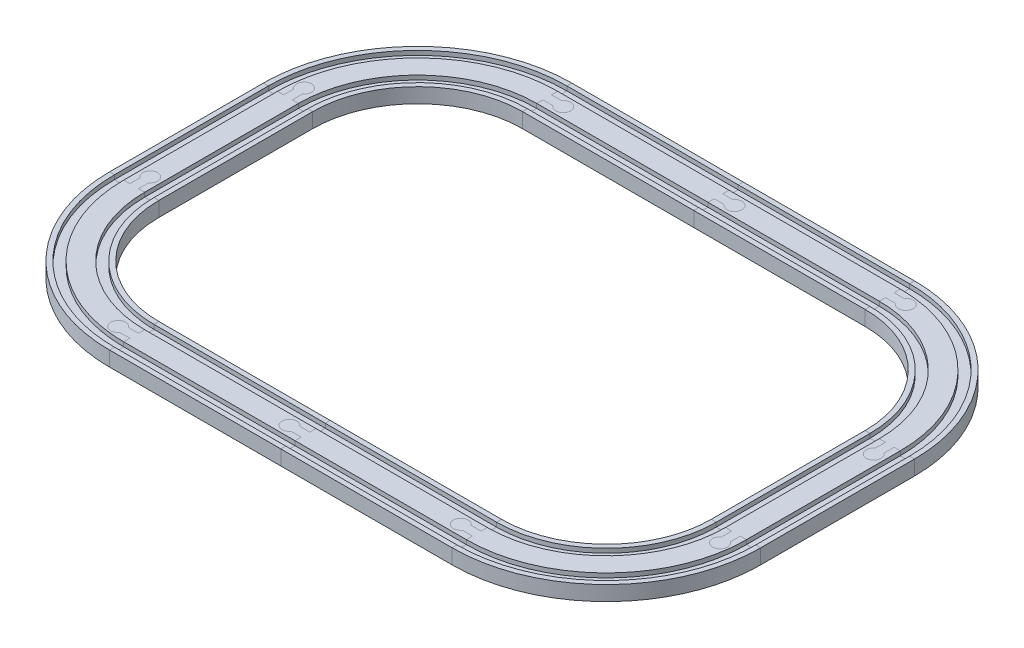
SolidWorks part; units mm, degrees
ref_plane "Front Plane" through (0, 0, 0) normal (0, 0, 1) x (1, 0, 0)
ref_plane "Top Plane" through (0, 0, 0) normal (0, 1, 0) x (1, 0, 0)
ref_plane "Right Plane" through (0, 0, 0) normal (1, 0, 0) x (0, 0, -1)
sketch "Sketch1" plane through (0, 0, 0) normal (0, 1, 0) x (1, 0, 0)
  line L0 (-984.3778, 325.8972) -> (-706.7779, 325.8972)
  line L1 (-1109.3778, 200.8972) -> (-1109.3778, 76.2735)
  line L2 (-621.7779, 200.8972) -> (-621.7779, 76.2735)
  line L3 (-1069.3778, 200.8972) -> (-1069.3778, 76.2735)
  line L4 (-581.7779, 200.8972) -> (-581.7779, 76.2735)
  line L5 (-706.7779, -48.7265) -> (-984.3778, -48.7265)
  line L6 (-984.3778, -8.7265) -> (-706.7779, -8.7265)
  spline S0 degree 2 poles (-706.7779, 325.8972) (-706.7779, 325.8972) (-706.7779, 325.8972) knots 0.111111 0.111111 0.111111 0.111111 0.111111 0.111111
  spline S1 degree 3 poles (-706.7779, 325.8972) (-638.0279, 325.8972) (-581.7779, 269.6472) (-581.7779, 200.8972) knots 0.111111 0.111111 0.111111 0.111111 0.222222 0.222222 0.222222 0.222222
  spline S3 degree 2 poles (-581.7779, 76.2735) (-581.7779, 76.2735) (-581.7779, 76.2735) knots 0.333333 0.333333 0.333333 0.333333 0.333333 0.333333
  spline S4 degree 3 poles (-581.7779, 76.2735) (-581.7779, 7.5235) (-638.0279, -48.7265) (-706.7779, -48.7265) knots 0.333333 0.333333 0.333333 0.333333 0.444444 0.444444 0.444444 0.444444
  spline S7 degree 3 poles (-984.3778, -48.7265) (-1053.1278, -48.7265) (-1109.3778, 7.5235) (-1109.3778, 76.2735) knots 0.555556 0.555556 0.555556 0.555556 0.666667 0.666667 0.666667 0.666667
  spline S9 degree 3 poles (-1109.3778, 200.8972) (-1109.3778, 269.6472) (-1053.1278, 325.8972) (-984.3778, 325.8972) knots 0.777778 0.777778 0.777778 0.777778 1 1 1 1
  spline S10 degree 3 poles (-984.3778, 285.8972) (-1031.0488, 285.8972) (-1069.3778, 247.5682) (-1069.3778, 200.8972) knots 0 0 0 0 0.111111 0.111111 0.111111 0.111111
  spline S12 degree 3 poles (-1069.3778, 76.2735) (-1069.3778, 29.6025) (-1031.0488, -8.7265) (-984.3778, -8.7265) knots 0.222222 0.222222 0.222222 0.222222 0.333333 0.333333 0.333333 0.333333
  spline S14 degree 3 poles (-706.7779, -8.7265) (-660.1069, -8.7265) (-621.7779, 29.6025) (-621.7779, 76.2735) knots 0.444444 0.444444 0.444444 0.444444 0.555556 0.555556 0.555556 0.555556
  spline S16 degree 3 poles (-621.7779, 200.8972) (-621.7779, 247.5682) (-660.1069, 285.8972) (-706.7779, 285.8972) knots 0.666667 0.666667 0.666667 0.666667 0.777778 0.777778 0.777778 0.777778
  spline S17 degree 2 poles (-706.7779, 285.8972) (-706.7779, 285.8972) (-984.3778, 285.8972) knots 0.777778 0.777778 0.777778 1 1 1
extrude "Boss-Extrude1" add sketch "Sketch1" along normal blind 12
sketch "Sketch2" plane through (0, 12, 0) normal (0, 1, 0) x (1, 0, 0)
  spline S0 degree 3 poles (-984.3778, 321.8972) (-1050.9199, 321.8972) (-1105.3778, 267.4393) (-1105.3778, 200.8972) knots 0 0 0 0 0.111111 0.111111 0.111111 0.111111
  spline S1 degree 2 poles (-1105.3778, 200.8972) (-1105.3778, 200.8972) (-1105.3778, 76.2735) knots 0.111111 0.111111 0.111111 0.222222 0.222222 0.222222
  spline S2 degree 2 poles (-1105.3778, 76.2735) (-1105.3778, 76.2735) (-1105.3778, 76.2735) knots 0.222222 0.222222 0.222222 0.222222 0.222222 0.222222
  spline S3 degree 3 poles (-1105.3778, 76.2735) (-1105.3778, 9.7314) (-1050.9199, -44.7265) (-984.3778, -44.7265) knots 0.222222 0.222222 0.222222 0.222222 0.333333 0.333333 0.333333 0.333333
  spline S4 degree 2 poles (-984.3778, -44.7265) (-984.3778, -44.7265) (-706.7779, -44.7265) knots 0.333333 0.333333 0.333333 0.444444 0.444444 0.444444
  spline S5 degree 2 poles (-706.7779, -44.7265) (-706.7779, -44.7265) (-706.7779, -44.7265) knots 0.444444 0.444444 0.444444 0.444444 0.444444 0.444444
  spline S6 degree 3 poles (-706.7779, -44.7265) (-640.2358, -44.7265) (-585.7779, 9.7314) (-585.7779, 76.2735) knots 0.444444 0.444444 0.444444 0.444444 0.555556 0.555556 0.555556 0.555556
  spline S7 degree 2 poles (-585.7779, 76.2735) (-585.7779, 76.2735) (-585.7779, 200.8972) knots 0.555556 0.555556 0.555556 0.666667 0.666667 0.666667
  spline S9 degree 3 poles (-585.7779, 200.8972) (-585.7779, 267.4393) (-640.2358, 321.8972) (-706.7779, 321.8972) knots 0.666667 0.666667 0.666667 0.666667 0.777778 0.777778 0.777778 0.777778
  spline S10 degree 2 poles (-706.7779, 321.8972) (-706.7779, 321.8972) (-984.3778, 321.8972) knots 0.777778 0.777778 0.777778 1 1 1
  spline S11 degree 3 poles (-984.3778, 314.3972) (-1046.7801, 314.3972) (-1097.8778, 263.2995) (-1097.8778, 200.8972) knots 0 0 0 0 0.111111 0.111111 0.111111 0.111111
  spline S12 degree 2 poles (-1097.8778, 200.8972) (-1097.8778, 200.8972) (-1097.8778, 76.2735) knots 0.111111 0.111111 0.111111 0.222222 0.222222 0.222222
  spline S13 degree 2 poles (-1097.8778, 76.2735) (-1097.8778, 76.2735) (-1097.8778, 76.2735) knots 0.222222 0.222222 0.222222 0.222222 0.222222 0.222222
  spline S14 degree 3 poles (-1097.8778, 76.2735) (-1097.8778, 13.8712) (-1046.7801, -37.2265) (-984.3778, -37.2265) knots 0.222222 0.222222 0.222222 0.222222 0.333333 0.333333 0.333333 0.333333
  spline S15 degree 2 poles (-984.3778, -37.2265) (-984.3778, -37.2265) (-706.7779, -37.2265) knots 0.333333 0.333333 0.333333 0.444444 0.444444 0.444444
  spline S16 degree 2 poles (-706.7779, -37.2265) (-706.7779, -37.2265) (-706.7779, -37.2265) knots 0.444444 0.444444 0.444444 0.444444 0.444444 0.444444
  spline S17 degree 3 poles (-706.7779, -37.2265) (-644.3756, -37.2265) (-593.2779, 13.8712) (-593.2779, 76.2735) knots 0.444444 0.444444 0.444444 0.444444 0.555556 0.555556 0.555556 0.555556
  spline S18 degree 2 poles (-593.2779, 76.2735) (-593.2779, 76.2735) (-593.2779, 200.8972) knots 0.555556 0.555556 0.555556 0.666667 0.666667 0.666667
  spline S20 degree 3 poles (-593.2779, 200.8972) (-593.2779, 263.2995) (-644.3756, 314.3972) (-706.7779, 314.3972) knots 0.666667 0.666667 0.666667 0.666667 0.777778 0.777778 0.777778 0.777778
  spline S21 degree 2 poles (-706.7779, 314.3972) (-706.7779, 314.3972) (-984.3778, 314.3972) knots 0.777778 0.777778 0.777778 1 1 1
  spline S22 degree 3 poles (-984.3778, 297.3972) (-1037.3965, 297.3972) (-1080.8778, 253.9159) (-1080.8778, 200.8972) knots 0 0 0 0 0.111111 0.111111 0.111111 0.111111
  spline S23 degree 2 poles (-1080.8778, 200.8972) (-1080.8778, 200.8972) (-1080.8778, 76.2735) knots 0.111111 0.111111 0.111111 0.222222 0.222222 0.222222
  spline S24 degree 3 poles (-1080.8778, 76.2735) (-1080.8778, 23.2548) (-1037.3965, -20.2265) (-984.3778, -20.2265) knots 0.222222 0.222222 0.222222 0.222222 0.333333 0.333333 0.333333 0.333333
  spline S25 degree 2 poles (-984.3778, -20.2265) (-984.3778, -20.2265) (-706.7779, -20.2265) knots 0.333333 0.333333 0.333333 0.444444 0.444444 0.444444
  spline S26 degree 3 poles (-706.7779, -20.2265) (-653.7592, -20.2265) (-610.2779, 23.2548) (-610.2779, 76.2735) knots 0.444444 0.444444 0.444444 0.444444 0.555556 0.555556 0.555556 0.555556
  spline S27 degree 2 poles (-610.2779, 76.2735) (-610.2779, 76.2735) (-610.2779, 200.8972) knots 0.555556 0.555556 0.555556 0.666667 0.666667 0.666667
  spline S28 degree 3 poles (-610.2779, 200.8972) (-610.2779, 253.9159) (-653.7592, 297.3972) (-706.7779, 297.3972) knots 0.666667 0.666667 0.666667 0.666667 0.777778 0.777778 0.777778 0.777778
  spline S29 degree 2 poles (-706.7779, 297.3972) (-706.7779, 297.3972) (-984.3778, 297.3972) knots 0.777778 0.777778 0.777778 1 1 1
  spline S30 degree 3 poles (-984.3778, 289.8972) (-1033.2567, 289.8972) (-1073.3778, 249.7761) (-1073.3778, 200.8972) knots 0 0 0 0 0.111111 0.111111 0.111111 0.111111
  spline S31 degree 2 poles (-1073.3778, 200.8972) (-1073.3778, 200.8972) (-1073.3778, 76.2735) knots 0.111111 0.111111 0.111111 0.222222 0.222222 0.222222
  spline S32 degree 3 poles (-1073.3778, 76.2735) (-1073.3778, 27.3946) (-1033.2567, -12.7265) (-984.3778, -12.7265) knots 0.222222 0.222222 0.222222 0.222222 0.333333 0.333333 0.333333 0.333333
  spline S33 degree 2 poles (-984.3778, -12.7265) (-984.3778, -12.7265) (-706.7779, -12.7265) knots 0.333333 0.333333 0.333333 0.444444 0.444444 0.444444
  spline S34 degree 3 poles (-706.7779, -12.7265) (-657.899, -12.7265) (-617.7779, 27.3946) (-617.7779, 76.2735) knots 0.444444 0.444444 0.444444 0.444444 0.555556 0.555556 0.555556 0.555556
  spline S35 degree 2 poles (-617.7779, 76.2735) (-617.7779, 76.2735) (-617.7779, 200.8972) knots 0.555556 0.555556 0.555556 0.666667 0.666667 0.666667
  spline S36 degree 3 poles (-617.7779, 200.8972) (-617.7779, 249.7761) (-657.899, 289.8972) (-706.7779, 289.8972) knots 0.666667 0.666667 0.666667 0.666667 0.777778 0.777778 0.777778 0.777778
  spline S37 degree 2 poles (-706.7779, 289.8972) (-706.7779, 289.8972) (-984.3778, 289.8972) knots 0.777778 0.777778 0.777778 1 1 1
extrude "Cut-Extrude1" cut sketch "Sketch2" against normal blind 3.5 contours S9 S10 S0 S1 S3 S4 S6 S7 S21 S20 S18 S17 S15 S14 S12 S11 | S28 S29 S22 S23 S24 S25 S26 S27 S37 S36 S35 S34 S33 S32 S31 S30
sketch "Sketch3" plane through (0, 12, 0) normal (0, 1, 0) x (1, 0, 0)
  line L0 (-984.3778, 325.8972) -> (-984.3778, 309.3971)
  line L1 (-845.5778, 325.8972) -> (-845.5778, 309.3971)
  line L2 (-706.7779, 325.8972) -> (-706.7779, 309.3971)
  line L3 (-706.7779, -8.7265) -> (-706.7779, -25.2266)
  line L4 (-845.5779, -8.7265) -> (-845.5779, -25.2266)
  line L5 (-984.3778, -8.7265) -> (-984.3778, -25.2266)
  line L6 (-621.7779, 200.8972) -> (-605.2778, 200.8972)
  line L7 (-621.7779, 76.2735) -> (-605.2778, 76.2735)
  line L8 (-1109.3778, 76.2735) -> (-1092.8777, 76.2735)
  line L9 (-1109.3778, 200.8972) -> (-1092.8777, 200.8972)
  line L10 (-1085.8777, 200.8972) -> (-1069.3778, 200.8972)
  line L11 (-1085.8777, 76.2735) -> (-1069.3778, 76.2735)
  line L12 (-984.3778, 302.3971) -> (-984.3778, 285.8972)
  line L13 (-845.5778, 302.3971) -> (-845.5778, 285.8972)
  line L14 (-984.3778, 285.8972) -> (-706.7779, 285.8972) construction
  line L15 (-706.7779, 302.3971) -> (-706.7779, 285.8972)
  line L16 (-598.2778, 200.8972) -> (-581.7779, 200.8972)
  line L17 (-598.2778, 76.2735) -> (-581.7779, 76.2735)
  line L18 (-706.7779, -32.2266) -> (-706.7779, -48.7265)
  line L19 (-845.5779, -32.2266) -> (-845.5779, -48.7265)
  line L21 (-984.3778, -32.2408) -> (-984.3778, -48.7265)
  spline S0 degree 2 poles (-984.3778, 309.3971) (-984.3778, 309.3971) (-976.2513, 309.3971) knots 0.111111 0.111111 0.111111 0.222222 0.222222 0.222222
  spline S1 degree 3 poles (-976.2513, 309.3971) (-975.1621, 310.9111) (-973.3852, 311.8971) (-971.3778, 311.8971) knots 0.222222 0.222222 0.222222 0.222222 0.333333 0.333333 0.333333 0.333333
  spline S2 degree 3 poles (-971.3778, 311.8971) (-968.0641, 311.8971) (-965.3778, 309.2108) (-965.3778, 305.8971) knots 0.333333 0.333333 0.333333 0.333333 0.444444 0.444444 0.444444 0.444444
  spline S3 degree 3 poles (-965.3778, 305.8971) (-965.3778, 302.5834) (-968.0641, 299.8971) (-971.3778, 299.8971) knots 0.444444 0.444444 0.444444 0.444444 0.555556 0.555556 0.555556 0.555556
  spline S4 degree 3 poles (-971.3778, 299.8971) (-973.3852, 299.8971) (-975.1621, 300.8831) (-976.2513, 302.3971) knots 0.555556 0.555556 0.555556 0.555556 0.666667 0.666667 0.666667 0.666667
  spline S5 degree 2 poles (-976.2513, 302.3971) (-976.2513, 302.3971) (-984.3778, 302.3971) knots 0.666667 0.666667 0.666667 0.777778 0.777778 0.777778
  spline S6 degree 2 poles (-845.5778, 309.3971) (-845.5778, 309.3971) (-837.4513, 309.3971) knots 0.111111 0.111111 0.111111 0.222222 0.222222 0.222222
  spline S7 degree 3 poles (-837.4513, 309.3971) (-836.3621, 310.9111) (-834.5852, 311.8971) (-832.5778, 311.8971) knots 0.222222 0.222222 0.222222 0.222222 0.333333 0.333333 0.333333 0.333333
  spline S8 degree 3 poles (-832.5778, 311.8971) (-829.2641, 311.8971) (-826.5778, 309.2108) (-826.5778, 305.8971) knots 0.333333 0.333333 0.333333 0.333333 0.444444 0.444444 0.444444 0.444444
  spline S9 degree 3 poles (-826.5778, 305.8971) (-826.5778, 302.5834) (-829.2641, 299.8971) (-832.5778, 299.8971) knots 0.444444 0.444444 0.444444 0.444444 0.555556 0.555556 0.555556 0.555556
  spline S10 degree 3 poles (-832.5778, 299.8971) (-834.5852, 299.8971) (-836.3621, 300.8831) (-837.4513, 302.3971) knots 0.555556 0.555556 0.555556 0.555556 0.666667 0.666667 0.666667 0.666667
  spline S11 degree 2 poles (-837.4513, 302.3971) (-837.4513, 302.3971) (-845.5778, 302.3971) knots 0.666667 0.666667 0.666667 0.777778 0.777778 0.777778
  spline S12 degree 2 poles (-706.7779, 309.3971) (-706.7779, 309.3971) (-698.6514, 309.3971) knots 0.111111 0.111111 0.111111 0.222222 0.222222 0.222222
  spline S13 degree 3 poles (-698.6514, 309.3971) (-697.5622, 310.9111) (-695.7853, 311.8971) (-693.7779, 311.8971) knots 0.222222 0.222222 0.222222 0.222222 0.333333 0.333333 0.333333 0.333333
  spline S14 degree 3 poles (-693.7779, 311.8971) (-690.4642, 311.8971) (-687.7779, 309.2108) (-687.7779, 305.8971) knots 0.333333 0.333333 0.333333 0.333333 0.444444 0.444444 0.444444 0.444444
  spline S15 degree 3 poles (-687.7779, 305.8971) (-687.7779, 302.5834) (-690.4642, 299.8971) (-693.7779, 299.8971) knots 0.444444 0.444444 0.444444 0.444444 0.555556 0.555556 0.555556 0.555556
  spline S16 degree 3 poles (-693.7779, 299.8971) (-695.7853, 299.8971) (-697.5622, 300.8831) (-698.6514, 302.3971) knots 0.555556 0.555556 0.555556 0.555556 0.666667 0.666667 0.666667 0.666667
  spline S17 degree 2 poles (-698.6514, 302.3971) (-698.6514, 302.3971) (-706.7779, 302.3971) knots 0.666667 0.666667 0.666667 0.777778 0.777778 0.777778
  spline S18 degree 2 poles (-706.7779, -25.2266) (-706.7779, -25.2266) (-714.9044, -25.2266) knots 0.111111 0.111111 0.111111 0.222222 0.222222 0.222222
  spline S19 degree 3 poles (-714.9044, -25.2266) (-715.9936, -23.7126) (-717.7705, -22.7266) (-719.7779, -22.7266) knots 0.222222 0.222222 0.222222 0.222222 0.333333 0.333333 0.333333 0.333333
  spline S20 degree 3 poles (-719.7779, -22.7266) (-723.0916, -22.7266) (-725.7779, -25.4129) (-725.7779, -28.7266) knots 0.333333 0.333333 0.333333 0.333333 0.444444 0.444444 0.444444 0.444444
  spline S21 degree 3 poles (-725.7779, -28.7266) (-725.7779, -32.0403) (-723.0916, -34.7266) (-719.7779, -34.7266) knots 0.444444 0.444444 0.444444 0.444444 0.555556 0.555556 0.555556 0.555556
  spline S22 degree 3 poles (-719.7779, -34.7266) (-717.7705, -34.7266) (-715.9936, -33.7406) (-714.9044, -32.2266) knots 0.555556 0.555556 0.555556 0.555556 0.666667 0.666667 0.666667 0.666667
  spline S23 degree 2 poles (-714.9044, -32.2266) (-714.9044, -32.2266) (-706.7779, -32.2266) knots 0.666667 0.666667 0.666667 0.777778 0.777778 0.777778
  spline S24 degree 2 poles (-845.5779, -25.2266) (-845.5779, -25.2266) (-853.7044, -25.2266) knots 0.111111 0.111111 0.111111 0.222222 0.222222 0.222222
  spline S25 degree 3 poles (-853.7044, -25.2266) (-854.7936, -23.7126) (-856.5705, -22.7266) (-858.5779, -22.7266) knots 0.222222 0.222222 0.222222 0.222222 0.333333 0.333333 0.333333 0.333333
  spline S26 degree 3 poles (-858.5779, -22.7266) (-861.8916, -22.7266) (-864.5779, -25.4129) (-864.5779, -28.7266) knots 0.333333 0.333333 0.333333 0.333333 0.444444 0.444444 0.444444 0.444444
  spline S27 degree 3 poles (-864.5779, -28.7266) (-864.5779, -32.0403) (-861.8916, -34.7266) (-858.5779, -34.7266) knots 0.444444 0.444444 0.444444 0.444444 0.555556 0.555556 0.555556 0.555556
  spline S28 degree 3 poles (-858.5779, -34.7266) (-856.5705, -34.7266) (-854.7936, -33.7406) (-853.7044, -32.2266) knots 0.555556 0.555556 0.555556 0.555556 0.666667 0.666667 0.666667 0.666667
  spline S29 degree 2 poles (-853.7044, -32.2266) (-853.7044, -32.2266) (-845.5779, -32.2266) knots 0.666667 0.666667 0.666667 0.777778 0.777778 0.777778
  spline S30 degree 2 poles (-984.3778, -25.2266) (-984.3778, -25.2266) (-992.5043, -25.2266) knots 0.111111 0.111111 0.111111 0.222222 0.222222 0.222222
  spline S31 degree 3 poles (-992.5043, -25.2266) (-993.5935, -23.7126) (-995.3704, -22.7266) (-997.3778, -22.7266) knots 0.222222 0.222222 0.222222 0.222222 0.333333 0.333333 0.333333 0.333333
  spline S32 degree 3 poles (-997.3778, -22.7266) (-1000.6915, -22.7266) (-1003.3778, -25.4129) (-1003.3778, -28.7266) knots 0.333333 0.333333 0.333333 0.333333 0.444444 0.444444 0.444444 0.444444
  spline S33 degree 3 poles (-1003.3778, -28.7266) (-1003.3778, -32.0403) (-1000.6915, -34.7266) (-997.3778, -34.7266) knots 0.444444 0.444444 0.444444 0.444444 0.555556 0.555556 0.555556 0.555556
  spline S34 degree 3 poles (-997.3778, -34.7266) (-995.3704, -34.7266) (-993.5935, -33.7406) (-992.5043, -32.2266) knots 0.555556 0.555556 0.555556 0.555556 0.666667 0.666667 0.666667 0.666667
  spline S35 degree 2 poles (-992.5043, -32.2266) (-992.5043, -32.2266) (-984.3778, -32.2408) knots 0.666667 0.666667 0.666667 0.777778 0.777778 0.777778
  spline S36 degree 2 poles (-605.2778, 200.8972) (-605.2778, 200.8972) (-605.2778, 192.7707) knots 0.111111 0.111111 0.111111 0.222222 0.222222 0.222222
  spline S37 degree 3 poles (-605.2778, 192.7707) (-606.7918, 191.6815) (-607.7778, 189.9046) (-607.7778, 187.8972) knots 0.222222 0.222222 0.222222 0.222222 0.333333 0.333333 0.333333 0.333333
  spline S38 degree 3 poles (-607.7778, 187.8972) (-607.7778, 184.5835) (-605.0915, 181.8972) (-601.7778, 181.8972) knots 0.333333 0.333333 0.333333 0.333333 0.444444 0.444444 0.444444 0.444444
  spline S39 degree 3 poles (-601.7778, 181.8972) (-598.4641, 181.8972) (-595.7778, 184.5835) (-595.7778, 187.8972) knots 0.444444 0.444444 0.444444 0.444444 0.555556 0.555556 0.555556 0.555556
  spline S40 degree 3 poles (-595.7778, 187.8972) (-595.7778, 189.9046) (-596.7638, 191.6815) (-598.2778, 192.7707) knots 0.555556 0.555556 0.555556 0.555556 0.666667 0.666667 0.666667 0.666667
  spline S41 degree 2 poles (-598.2778, 192.7707) (-598.2778, 192.7707) (-598.2778, 200.8972) knots 0.666667 0.666667 0.666667 0.777778 0.777778 0.777778
  spline S42 degree 2 poles (-605.2778, 76.2735) (-605.2778, 76.2735) (-605.2778, 68.147) knots 0.111111 0.111111 0.111111 0.222222 0.222222 0.222222
  spline S43 degree 3 poles (-605.2778, 68.147) (-606.7918, 67.0578) (-607.7778, 65.2809) (-607.7778, 63.2735) knots 0.222222 0.222222 0.222222 0.222222 0.333333 0.333333 0.333333 0.333333
  spline S44 degree 3 poles (-607.7778, 63.2735) (-607.7778, 59.9598) (-605.0915, 57.2735) (-601.7778, 57.2735) knots 0.333333 0.333333 0.333333 0.333333 0.444444 0.444444 0.444444 0.444444
  spline S45 degree 3 poles (-601.7778, 57.2735) (-598.4641, 57.2735) (-595.7778, 59.9598) (-595.7778, 63.2735) knots 0.444444 0.444444 0.444444 0.444444 0.555556 0.555556 0.555556 0.555556
  spline S46 degree 3 poles (-595.7778, 63.2735) (-595.7778, 65.2809) (-596.7638, 67.0578) (-598.2778, 68.147) knots 0.555556 0.555556 0.555556 0.555556 0.666667 0.666667 0.666667 0.666667
  spline S47 degree 2 poles (-598.2778, 68.147) (-598.2778, 68.147) (-598.2778, 76.2735) knots 0.666667 0.666667 0.666667 0.777778 0.777778 0.777778
  spline S48 degree 2 poles (-1092.8777, 76.2735) (-1092.8777, 76.2735) (-1092.8777, 84.4) knots 0.111111 0.111111 0.111111 0.222222 0.222222 0.222222
  spline S49 degree 3 poles (-1092.8777, 84.4) (-1094.3917, 85.4892) (-1095.3777, 87.2661) (-1095.3777, 89.2735) knots 0.222222 0.222222 0.222222 0.222222 0.333333 0.333333 0.333333 0.333333
  spline S50 degree 3 poles (-1095.3777, 89.2735) (-1095.3777, 92.5872) (-1092.6914, 95.2735) (-1089.3777, 95.2735) knots 0.333333 0.333333 0.333333 0.333333 0.444444 0.444444 0.444444 0.444444
  spline S51 degree 3 poles (-1089.3777, 95.2735) (-1086.064, 95.2735) (-1083.3777, 92.5872) (-1083.3777, 89.2735) knots 0.444444 0.444444 0.444444 0.444444 0.555556 0.555556 0.555556 0.555556
  spline S52 degree 3 poles (-1083.3777, 89.2735) (-1083.3777, 87.2661) (-1084.3637, 85.4892) (-1085.8777, 84.4) knots 0.555556 0.555556 0.555556 0.555556 0.666667 0.666667 0.666667 0.666667
  spline S53 degree 2 poles (-1085.8777, 84.4) (-1085.8777, 84.4) (-1085.8777, 76.2735) knots 0.666667 0.666667 0.666667 0.777778 0.777778 0.777778
  spline S54 degree 2 poles (-1092.8777, 200.8972) (-1092.8777, 200.8972) (-1092.8777, 209.0237) knots 0.111111 0.111111 0.111111 0.222222 0.222222 0.222222
  spline S55 degree 3 poles (-1092.8777, 209.0237) (-1094.3917, 210.1129) (-1095.3777, 211.8898) (-1095.3777, 213.8972) knots 0.222222 0.222222 0.222222 0.222222 0.333333 0.333333 0.333333 0.333333
  spline S56 degree 3 poles (-1095.3777, 213.8972) (-1095.3777, 217.2109) (-1092.6914, 219.8972) (-1089.3777, 219.8972) knots 0.333333 0.333333 0.333333 0.333333 0.444444 0.444444 0.444444 0.444444
  spline S57 degree 3 poles (-1089.3777, 219.8972) (-1086.064, 219.8972) (-1083.3777, 217.2109) (-1083.3777, 213.8972) knots 0.444444 0.444444 0.444444 0.444444 0.555556 0.555556 0.555556 0.555556
  spline S58 degree 3 poles (-1083.3777, 213.8972) (-1083.3777, 211.8898) (-1084.3637, 210.1129) (-1085.8777, 209.0237) knots 0.555556 0.555556 0.555556 0.555556 0.666667 0.666667 0.666667 0.666667
  spline S59 degree 2 poles (-1085.8777, 209.0237) (-1085.8777, 209.0237) (-1085.8777, 200.8972) knots 0.666667 0.666667 0.666667 0.777778 0.777778 0.777778
split "Split1" trim tools "Sketch3" bodies to split 102 resulting bodies 103 104 105 106 107 108 109 110 111 112
sketch "Sketch4" plane through (0, 12, 0) normal (0, 1, 0) x (1, 0, 0)
  spline S1 degree 3 poles (-727.2156, -28.5801) (-706.5315, -28.9228) (-687.406, -27.5661) (-665.5853, -21.1145) (-642.3128, -7.5155) (-622.8165, 11.7682) (-610.2898, 33.5663) (-604.2238, 52.8745) (-601.9394, 67.2236) (-601.6404, 83.7943) (-601.853, 106.3351) (-601.7123, 139.3148) (-601.9046, 169.5709) (-601.6368, 196.6258) (-602.2658, 217.5829) (-612.9736, 255.0022) (-640.9195, 287.0004) (-675.9859, 301.7753) (-694.3591, 305.5449) (-709.2638, 305.9827) (-729.5074, 305.9714) (-762.1728, 305.8681) (-813.7574, 305.8974) (-869.5519, 305.9618) (-927.7801, 305.7164) (-967.4977, 306.422) (-995.705, 305.5126) (-1013.5757, 302.2267) (-1033.3624, 294.4053) (-1058.2037, 277.3462) (-1077.3387, 252.8269) (-1086.5258, 227.15) (-1089.0153, 210.7869) (-1089.5198, 197.9807) (-1089.2964, 180.7255) (-1089.4062, 159.6812) (-1089.3613, 136.0751) (-1089.4199, 113.3451) (-1089.2936, 92.0209) (-1089.6015, 71.8426) (-1087.3289, 53.3559) (-1081.0455, 34.646) (-1068.9917, 12.5757) (-1049.9961, -7.0428) (-1026.7501, -20.2312) (-1006.5176, -26.8812) (-987.7119, -28.9779) (-970.1366, -28.7306) (-950.5259, -28.6723) (-918.655, -28.7749) (-875.3992, -28.7185) (-817.2518, -28.7037) (-766.3028, -28.8449) (-727.2156, -28.5801) (-706.5315, -28.9228) (-687.406, -27.5661) knots -0.080328 -0.031908 -0.010093 0 0.0106 0.029208 0.046153 0.065549 0.08487 0.097173 0.106978 0.114613 0.131198 0.153316 0.182389 0.19335 0.208973 0.22523 0.272774 0.28895 0.303052 0.311006 0.31956 0.344662 0.378132 0.425573 0.459329 0.497783 0.507235 0.517246 0.534986 0.550487 0.578797 0.597085 0.605972 0.612718 0.623401 0.641434 0.655965 0.671914 0.688146 0.699792 0.713373 0.726185 0.740116 0.764811 0.78104 0.79466 0.80829 0.819704 0.830777 0.848593 0.885201 0.919672 0.968092 0.989907 1 1.0106 1.029208 1.046153 only from (-706.7779, -28.709) to (-706.7779, -28.709)
